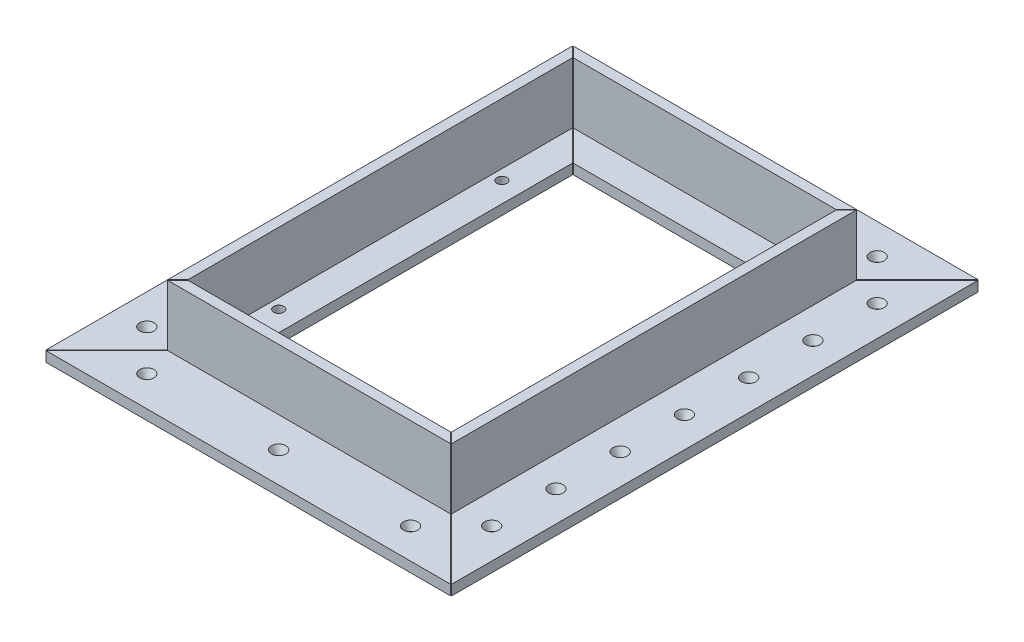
SolidWorks part; units mm, degrees
ref_plane "Front Plane" through (0, 0, 0) normal (0, 0, 1) x (1, 0, 0)
ref_plane "Top Plane" through (0, 0, 0) normal (0, 1, 0) x (1, 0, 0)
ref_plane "Right Plane" through (0, 0, 0) normal (1, 0, 0) x (0, 0, -1)
sketch "Sketch1" plane through (0, 0, 0) normal (0, 0, 1) x (1, 0, 0)
  line L0 (-44.45, 0) -> (-41.275, 0)
  line L1 (-41.275, 0) -> (-41.275, -19.05)
  line L2 (-44.45, 0) -> (-44.45, -19.05)
  line L3 (-44.45, -19.05) -> (-63.5, -19.05)
  line L4 (-63.5, -19.05) -> (-63.5, -22.225)
  line L5 (-63.5, -22.225) -> (-31.75, -22.225)
  line L8 (-31.75, -22.225) -> (-31.75, -19.05)
  line L9 (-31.75, -19.05) -> (-41.275, -19.05)
  line L10 (0, 0) -> (0, -19.05) construction
  line L11 (-41.275, -19.05) -> (41.275, -19.05) construction
  line L12 (-25.4, 0) -> (-22.225, 0) construction
  line L13 (-34.925, -19.05) -> (-31.75, -19.05) construction
  line L14 (-34.925, -19.05) -> (-34.925, 0) construction
  line L15 (-34.925, 0) -> (-31.75, 0) construction
  line L16 (-31.75, -19.05) -> (-31.75, 0) construction
  line L17 (-25.4, -19.05) -> (-25.4, 0) construction
  line L18 (-22.225, -19.05) -> (-22.225, 0) construction
  line L19 (-25.4, -19.05) -> (-22.225, -19.05) construction
  line L20 (-15.875, 0) -> (-12.7, 0) construction
  line L21 (-15.875, -19.05) -> (-15.875, 0) construction
  line L22 (-12.7, -19.05) -> (-12.7, 0) construction
  line L23 (-15.875, -19.05) -> (-12.7, -19.05) construction
  line L24 (-6.35, 0) -> (-3.175, 0) construction
  line L25 (-6.35, -19.05) -> (-6.35, 0) construction
  line L26 (-3.175, -19.05) -> (-3.175, 0) construction
  line L27 (-6.35, -19.05) -> (-3.175, -19.05) construction
  line L28 (3.175, 0) -> (6.35, 0) construction
  line L29 (3.175, -19.05) -> (3.175, 0) construction
  line L30 (6.35, -19.05) -> (6.35, 0) construction
  line L31 (3.175, -19.05) -> (6.35, -19.05) construction
  line L32 (12.7, 0) -> (15.875, 0) construction
  line L33 (12.7, -19.05) -> (12.7, 0) construction
  line L34 (15.875, -19.05) -> (15.875, 0) construction
  line L35 (12.7, -19.05) -> (15.875, -19.05) construction
  line L36 (22.225, 0) -> (25.4, 0) construction
  line L37 (22.225, -19.05) -> (22.225, 0) construction
  line L38 (25.4, -19.05) -> (25.4, 0) construction
  line L39 (22.225, -19.05) -> (25.4, -19.05) construction
  line L40 (31.75, 0) -> (34.925, 0) construction
  line L41 (31.75, -19.05) -> (31.75, 0) construction
  line L42 (34.925, -19.05) -> (34.925, 0) construction
  line L43 (31.75, -19.05) -> (34.925, -19.05) construction
  line L44 (31.75, -22.225) -> (31.75, -19.05)
  line L45 (31.75, -19.05) -> (41.275, -19.05)
  line L46 (63.5, -22.225) -> (31.75, -22.225)
  line L47 (63.5, -19.05) -> (63.5, -22.225)
  line L48 (44.45, -19.05) -> (63.5, -19.05)
  line L49 (44.45, 0) -> (44.45, -19.05)
  line L50 (41.275, 0) -> (41.275, -19.05)
  line L51 (44.45, 0) -> (41.275, 0)
  point P15 (0, -19.05)
  point P21 (0, 0)
  dimension "D1" = 12.7
  dimension "D2" = 3.175
  dimension "D3" = 31.75
  dimension "D4" = 22.225
  dimension "D5" = 6.35
  dimension "D6" = 3.175
  dimension "D8" = 6.35
  dimension "D7" = 8
extrude "Boss-Extrude1" add sketch "Sketch1" along normal mid plane 127
sketch "Sketch2" plane through (0, 0, 0) normal (1, 0, 0) x (0, 0, -1)
  line L0 (-63.5, -19.05) -> (63.5, -19.05) construction
  line L1 (-63.5, 0) -> (-60.325, 0)
  line L2 (-63.5, 0) -> (-63.5, -19.05)
  line L4 (-60.325, 0) -> (-60.325, -19.05)
  line L5 (-63.5, -22.225) -> (63.5, -22.225) construction
  line L6 (-82.55, -19.05) -> (-63.5, -19.05)
  line L7 (-82.55, -19.05) -> (-82.55, -22.225)
  line L8 (-82.55, -22.225) -> (-50.8, -22.225)
  line L9 (-50.8, -19.05) -> (-50.8, -22.225)
  line L10 (-60.325, -19.05) -> (-50.8, -19.05)
  line L11 (-63.5, -22.225) -> (-63.5, -19.05) construction
  line L12 (0, 0) -> (0, -51.8779) construction
  line L13 (60.325, -19.05) -> (50.8, -19.05)
  line L14 (50.8, -19.05) -> (50.8, -22.225)
  line L15 (82.55, -22.225) -> (50.8, -22.225)
  line L16 (82.55, -19.05) -> (82.55, -22.225)
  line L17 (82.55, -19.05) -> (63.5, -19.05)
  line L18 (60.325, 0) -> (60.325, -19.05)
  line L19 (63.5, 0) -> (63.5, -19.05)
  line L20 (63.5, 0) -> (60.325, 0)
  dimension "D1" = 12.7
  dimension "D2" = 31.75
extrude "Boss-Extrude2" add sketch "Sketch2" against normal up to vertex and the other way up to surface
sketch "Sketch3" plane through (0, -19.05, 0) normal (0, 1, 0) x (1, 0, 0)
  line L0 (44.45, 63.5) -> (44.45, 82.55) construction
  line L1 (-44.45, -63.5) -> (-63.5, -63.5) construction
  line L2 (-44.45, -63.5) -> (-44.45, -82.55) construction
  line L3 (-44.45, 63.5) -> (-63.5, 63.5) construction
  line L4 (-44.45, 82.55) -> (-44.45, 63.5) construction
  line L5 (63.5, -63.5) -> (44.45, -63.5) construction
  line L6 (44.45, -82.55) -> (44.45, -63.5) construction
  line L7 (63.5, 63.5) -> (44.45, 63.5) construction
  line L8 (-44.45, 82.55) -> (-44.45, 63.5)
  line L9 (-44.45, 63.5) -> (-63.5, 63.5)
  line L10 (-44.45, -63.5) -> (-63.5, -63.5)
  line L11 (-44.45, -63.5) -> (-44.45, -82.55)
  line L12 (63.5, -63.5) -> (44.45, -63.5)
  line L13 (44.45, -82.55) -> (44.45, -63.5)
  line L14 (63.5, 63.5) -> (44.45, 63.5)
  line L15 (44.45, 63.5) -> (44.45, 82.55)
  line L16 (-63.5, 63.5) -> (-63.5, 82.55)
  line L17 (-63.5, -82.55) -> (-44.45, -82.55)
  line L18 (-63.5, -82.55) -> (-63.5, -63.5)
  line L19 (-63.5, 82.55) -> (-44.45, 82.55)
  line L20 (63.5, -82.55) -> (63.5, -63.5)
  line L21 (44.45, 82.55) -> (63.5, 82.55)
  line L22 (63.5, 63.5) -> (63.5, 82.55)
  line L23 (44.45, -82.55) -> (63.5, -82.55)
extrude "Boss-Extrude3" add sketch "Sketch3" against normal up to surface (3.175 mm away)
sketch "Sketch4" plane through (0, -19.05, 0) normal (0, 1, 0) x (1, 0, 0)
  line L0 (-63.5, -82.55) -> (-63.5, 82.55) construction
  line L1 (-53.975, 73.025) -> (53.975, 73.025) construction
  line L2 (-53.975, 73.025) -> (-53.975, -73.025) construction
  line L3 (-53.975, -73.025) -> (53.975, -73.025) construction
  line L4 (53.975, 73.025) -> (53.975, -73.025) construction
  line L5 (-63.5, -82.55) -> (63.5, -82.55) construction
  line L6 (63.5, -82.55) -> (63.5, 82.55) construction
  line L7 (-63.5, 82.55) -> (63.5, 82.55) construction
  point P12 (-53.975, -60.325)
  point P13 (-41.275, -73.025)
  point P14 (0, -73.025)
  point P15 (41.275, -73.025)
  point P16 (-41.275, 73.025)
  point P17 (0, 73.025)
  point P18 (41.275, 73.025)
  point P19 (53.975, -1.4272)
  point P20 (-53.975, -40.2167)
  point P21 (-53.975, -20.1083)
  point P22 (-53.975, 0)
  point P23 (-53.975, 20.1083)
  point P24 (-53.975, 40.2167)
  point P25 (-53.975, 60.325)
  point P26 (53.975, -40.2167)
  point P27 (53.975, -20.1083)
  point P28 (53.975, -60.325)
  point P29 (53.975, 0)
  point P30 (53.975, 20.1083)
  point P31 (53.975, 40.2167)
  point P32 (53.975, 60.325)
  point P33 (53.975, 0)
  point P34 (0, 0)
  dimension "D1" = 9.525
  dimension "D2" = 9.525
  dimension "D3" = 9.525
  dimension "D4" = 9.525
  dimension "D5" = 12.7
  dimension "D8" = 12.7
  dimension "D9" = 12.7
  dimension "D6" = 7
  dimension "D7" = 7
ref_plane "Plane1" through (0, 0, 60.325) normal (0, 0, 1) x (1, 0, 0)
sketch "Sketch5" plane through (0, 0, 60.325) normal (0, 0, 1) x (1, 0, 0)
  line L0 (-53.975, -31.75) -> (-53.975, -20.5396)
  line L1 (-52.9341, -21.3) -> (-51.7245, -19.05)
  line L2 (-53.975, -19.05) -> (-53.975, -20.5396)
  line L3 (-63.5, -19.05) -> (63.5, -19.05) construction
  line L6 (-53.975, -19.05) -> (-51.7245, -19.05)
  line L8 (-52.9341, -21.3) -> (-52.9378, -26.1182)
  line L10 (-53.5799, -27.5501) -> (-53.8568, -27.55)
  line L12 (-53.7059, -28.2227) -> (-53.8816, -28.2226)
  line L14 (-53.7291, -28.9061) -> (-53.8875, -28.906)
  line L16 (-53.8108, -29.5777) -> (-53.8945, -29.5776)
  line L18 (-53.863, -30.2447) -> (-53.9457, -30.2446)
  ellipse E1 centre (-54.0383, -29.901) end of major axis (-54.5022, -29.9009) minor radius 0.3711 (-53.863, -30.2447) -> (-53.8108, -29.5777) ccw
  ellipse E4 centre (-53.9109, -29.2309) end of major axis (-54.3558, -29.2307) minor radius 0.3559 (-53.8108, -29.5777) -> (-53.7291, -28.9061) ccw
  ellipse E5 centre (-53.8004, -28.5626) end of major axis (-54.2357, -28.5624) minor radius 0.3482 (-53.7291, -28.9061) -> (-53.7059, -28.2227) ccw
  ellipse E6 centre (-53.6009, -27.1953) end of major axis (-54.0449, -27.1952) minor radius 0.3551 (-53.5799, -27.5501) -> (-53.7047, -26.85) ccw
  ellipse E8 centre (-53.717, -27.8775) end of major axis (-53.2854, -27.8776) minor radius 0.3453 (-53.7059, -28.2227) -> (-53.5799, -27.5501) ccw
  ellipse E10 centre (-53.8334, -26.1406) end of major axis (-52.9374, -26.141) minor radius 0.7168 (-53.6792, -26.8468) -> (-52.9378, -26.1182) ccw
  ellipse E13 centre (-55.9113, -31.4669) end of major axis (-53.8178, -31.2882) minor radius 1.0596 (-53.975, -31.75) -> (-53.9157, -31.0161) ccw
  ellipse E15 centre (-54.3411, -30.6105) end of major axis (-53.6795, -30.6108) minor radius 0.5293 (-53.9157, -31.0161) -> (-53.863, -30.2447) ccw
  point P4 (-53.975, -19.05)
  dimension "D1" = 12.7
revolve "Cut-Revolve1" cut sketch "Sketch5" angle 360 about L0
sketch "Sketch6" plane through (0, -19.05, 0) normal (0, 1, 0) x (1, 0, 0)
  point P0 (-53.975, 20.1083)
  point P2 (-53.975, 0)
  point P4 (-53.975, 40.2167)
  point P6 (-53.975, 60.325)
  point P8 (-41.275, 73.025)
  point P10 (0, 73.025)
  point P12 (41.275, 73.025)
  point P14 (53.975, 0)
  point P16 (53.975, 20.1083)
  point P18 (53.975, 40.2167)
  point P20 (53.975, 60.325)
  point P22 (53.975, -40.2167)
  point P24 (53.975, -20.1083)
  point P26 (53.975, -60.325)
  point P28 (41.275, -73.025)
  point P30 (0, -73.025)
  point P32 (-41.275, -73.025)
  point P34 (-53.975, -40.2167)
  point P36 (-53.975, -20.1083)
pattern_sketch "Sketch-Pattern1" of "Cut-Revolve1"
sketch "Sketch7" plane through (0, -19.05, 0) normal (0, 1, 0) x (1, 0, 0)
  circle A4 centre (-38.1, 34.925) radius 1.5875
  circle A5 centre (38.1, 34.925) radius 1.5875
  circle A6 centre (38.1, -34.925) radius 1.5875
  circle A7 centre (-38.1, -34.925) radius 1.5875
extrude "Cut-Extrude1" cut sketch "Sketch7" against normal through all both and the other way through all
sketch "Sketch8" plane through (0, -19.05, 0) normal (0, 1, 0) x (1, 0, 0)
  line L0 (63.5, 82.55) -> (44.45, 63.5)
  line L1 (44.45, 63.5) -> (41.275, 60.325)
  line L2 (41.275, 60.325) -> (31.75, 50.8)
  line L3 (31.75, -50.8) -> (41.275, -60.325)
  line L4 (41.275, -60.325) -> (44.45, -63.5)
  line L5 (44.45, -63.5) -> (63.5, -82.55)
  line L6 (-31.75, -50.8) -> (-41.275, -60.325)
  line L7 (-41.275, -60.325) -> (-44.45, -63.5)
  line L8 (-44.45, -63.5) -> (-63.5, -82.55)
  line L9 (-63.5, 82.55) -> (-44.45, 63.5)
  line L10 (-44.45, 63.5) -> (-41.275, 60.325)
  line L11 (-41.275, 60.325) -> (-31.75, 50.8)
  line L12 (-31.75, 50.8) -> (-6.5999, 25.6499)
  line L13 (6.2964, 25.3464) -> (31.75, 50.8)
  line L14 (31.75, -50.8) -> (3.9862, -23.0362)
  line L15 (-15.0584, -34.1084) -> (-31.75, -50.8)
extrude "Cut-Extrude-Thin1" cut sketch "Sketch8" against normal through all both and the other way through all thin
